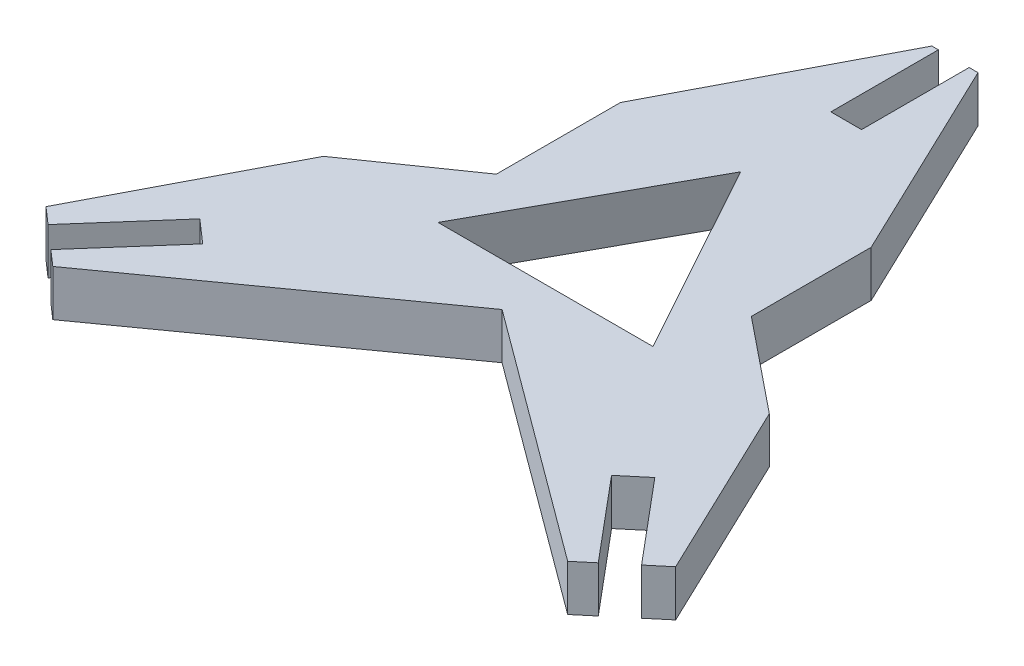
SolidWorks part; units mm, degrees
ref_plane "Front Plane" through (0, 0, 0) normal (0, 0, 1) x (1, 0, 0)
ref_plane "Top Plane" through (0, 0, 0) normal (0, 1, 0) x (1, 0, 0)
ref_plane "Right Plane" through (0, 0, 0) normal (1, 0, 0) x (0, 0, -1)
sketch "Sketch1" plane through (0, 0, 0) normal (0, 1, 0) x (1, 0, 0)
  line L0 (0, -50) -> (26.1043, 0)
  line L5 (26.1043, 0) -> (50, -50)
  line L6 (9.4838, -31.8347) -> (41.3186, -31.8347) construction
  line L7 (0, -50) -> (25.4012, -31.8347)
  line L8 (25.4012, -31.8347) -> (50, -50)
  line L9 (18.6558, -31.8347) -> (25.4012, -16.1881)
  line L10 (25.4012, -16.1881) -> (33.7221, -31.8347)
  line L11 (33.7221, -31.8347) -> (18.6558, -31.8347)
  dimension "D1" = 9.1719
  dimension "D2" = 7.5964
extrude "Boss-Extrude7" add sketch "Sketch1" along normal blind 3 contours L11 L10 L9 | L0 L6 L9 L10 L5 | L6 L0 L7 L11 | L6 L11 L8 L5
sketch "Sketch2" plane through (0, 3, 0) normal (0, 1, 0) x (1, 0, 0)
  line L0 (25.4012, -31.8347) -> (41.6032, -31.8347) construction
  line L1 (41.6032, -31.8347) -> (9.4838, -31.8347) construction
  line L2 (0, -50) -> (26.1043, 0) construction
  line L3 (18.4077, -29.0113) -> (32.3947, -29.0113)
  line L4 (32.3947, -29.0113) -> (25.4012, -16.3147)
  line L5 (25.4012, -16.3147) -> (18.4077, -29.0113)
  point P9 (25.4012, -29.0113)
extrude "Cut-Extrude3" cut sketch "Sketch2" against normal blind 3
sketch "Sketch3" plane through (0, 3, 0) normal (0, 1, 0) x (1, 0, 0)
  line L0 (0, -50) -> (18.4077, -29.0113) construction
  line L1 (18.4077, -29.0113) -> (32.3947, -29.0113) construction
  line L2 (32.3947, -29.0113) -> (50, -50) construction
  line L3 (50, -50) -> (25.4012, -31.8347) construction
  line L4 (25.4012, -31.8347) -> (26.1043, 0) construction
  line L5 (26.1043, 0) -> (50, -50) construction
  line L6 (0, -50) -> (26.1043, 0) construction
  line L7 (7.3455, -43.1412) -> (11.9611, -37.8784)
  line L8 (7.3455, -43.1412) -> (5.8419, -41.8224)
  line L9 (11.9611, -37.8784) -> (10.4574, -36.5597)
  line L10 (5.8419, -41.8224) -> (10.4574, -36.5597)
  line L11 (4.8333, -40.9379) -> (8.3541, -44.0257)
  line L12 (0, -50) -> (25.4012, -31.8347) construction
  line L13 (44.3396, -41.6958) -> (39.8411, -36.3327)
  line L14 (44.3396, -41.6958) -> (42.8073, -42.9811)
  line L15 (39.8411, -36.3327) -> (38.3088, -37.618)
  line L16 (42.8073, -42.9811) -> (38.3088, -37.618)
  line L17 (8.3541, -44.0257) -> (0, -50)
  line L18 (0, -50) -> (4.7312, -40.9379)
  line L19 (4.8333, -40.9379) -> (4.7633, -40.8765)
  line L20 (4.7633, -40.8765) -> (4.7312, -40.9379)
  line L21 (41.5998, -43.994) -> (45.5472, -40.6829)
  line L22 (45.5472, -40.6829) -> (50, -50)
  line L23 (50, -50) -> (41.5998, -43.994)
  point P28 (6.5937, -42.4818)
  point P33 (43.5735, -42.3384)
  dimension "D1" = 2
  dimension "D2" = 1
  dimension "D3" = 2
  dimension "D4" = 1
  dimension "D5" = 10
  dimension "D6" = 7
  dimension "D7" = 10
  dimension "D8" = 7
extrude "Cut-Extrude4" cut sketch "Sketch3" against normal blind 3 contours L10 L8 L7 L9 | L16 L14 L13 L15 | L21 L14 M14 M15 | L18 L20 L19 L11 L17
sketch "Sketch4" plane through (0, 3, 0) normal (0, 1, 0) x (1, 0, 0)
  line L0 (25.4012, -31.8347) -> (26.1043, 0) construction
  line L1 (24.9608, -3) -> (26.1043, 0)
  line L2 (24.9608, -3) -> (26.9608, -3)
  line L3 (24.9608, -3) -> (24.9608, -10)
  line L4 (24.9608, -10) -> (26.9608, -10)
  line L5 (26.9608, -3) -> (26.9608, -10)
  line L6 (24.9608, -3) -> (26.9608, -10) construction
  line L7 (24.9608, -10) -> (26.9608, -3) construction
  line L8 (26.9608, -3) -> (27.5381, -3)
  line L9 (26.1043, 0) -> (45.5472, -40.6829) construction
  line L10 (27.5381, -3) -> (26.1043, 0)
  line L11 (24.9608, -3) -> (24.5381, -3)
  line L12 (4.7633, -40.8765) -> (26.1043, 0) construction
  point P4 (25.9608, -6.5)
  dimension "D1" = 2
  dimension "D2" = 3
  dimension "D3" = 7
extrude "Cut-Extrude5" cut sketch "Sketch4" against normal blind 3 contours L5 L2 L3 L4 M16 | L2 L8 M15 M16
sketch "Sketch5" plane through (0, 3, 0) normal (0, 1, 0) x (1, 0, 0)
  line L0 (10.9579, -29.0113) -> (39.9692, -29.0113) construction
  line L1 (4.7633, -40.8765) -> (26.1043, 0) construction
  line L2 (27.5381, -3) -> (45.5472, -40.6829) construction
  line L3 (25.4012, -16.3147) -> (33.9013, -16.3147) construction
  line L4 (33.9013, -16.3147) -> (17.5866, -16.3147) construction
  line L5 (10.9579, -29.0113) -> (17.5866, -16.3147)
  line L6 (17.5866, -16.3147) -> (17.5866, -24.3934)
  line L7 (17.5866, -24.3934) -> (10.9579, -29.0113)
  line L8 (25.4636, -29.0113) -> (25.4012, -16.3147) construction
  line L9 (33.9013, -16.3147) -> (39.9692, -29.0113)
  line L10 (39.9692, -29.0113) -> (33.9013, -24.1129)
  line L11 (33.9013, -24.1129) -> (33.9013, -16.3147)
extrude "Cut-Extrude6" cut sketch "Sketch5" against normal blind 3
sketch "Sketch6" plane through (0, 3, 0) normal (0, 1, 0) x (1, 0, 0)
  line L0 (24.9608, -3) -> (24.5381, -3)
  line L1 (17.5866, -16.3147) -> (26.1043, 0) construction
  line L2 (24.5381, -3) -> (26.1043, 0)
  line L3 (26.1043, 0) -> (24.9608, -3)
extrude "Cut-Extrude8" cut sketch "Sketch6" against normal blind 4.25
